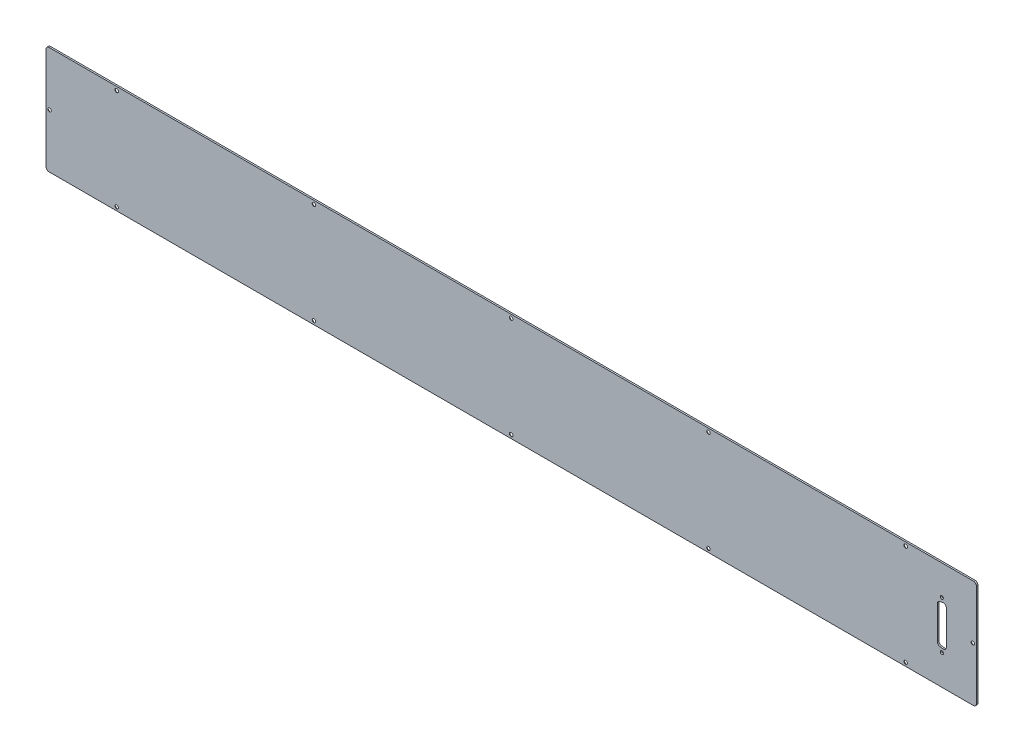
SolidWorks part; units mm, degrees
ref_plane "Front Plane" through (0, 0, 0) normal (0, 0, 1) x (1, 0, 0)
ref_plane "Top Plane" through (0, 0, 0) normal (0, 1, 0) x (1, 0, 0)
ref_plane "Right Plane" through (0, 0, 0) normal (1, 0, 0) x (0, 0, -1)
sketch "Sketch1" plane through (0, 0, 0) normal (0, 0, 1) x (1, 0, 0)
  line L1 (-457.5, -53) -> (457.5, -53)
  line L2 (-457.5, -53) -> (-457.5, 53)
  line L3 (-457.5, 53) -> (457.5, 53)
  line L4 (457.5, -53) -> (457.5, 53)
  line L5 (-457.5, -53) -> (457.5, 53) construction
  line L6 (-457.5, 53) -> (457.5, -53) construction
  point P0 (0, 0)
  dimension "D1" = 106
  dimension "D2" = 915
extrude "Boss-Extrude1" add sketch "Sketch1" along normal blind 1.5748
fillet "Fillet1" radius 3 4 edges at (-457.5, -53, 0.7874) (-457.5, 53, 0.7874) (457.5, -53, 0.7874) (457.5, 53, 0.7874)
hole_wizard "CSK for M3 Flat Head Machine Screw1" positions "Sketch3" profile "Sketch4" countersink size "M3" standard "ANSI Metric"
sketch "Sketch3" plane through (-335.0166, 20.5612, 0) normal (0, 0, 1) x (1, 0, 0)
  line L0 (335.0166, -20.5612) -> (-122.4834, -20.5612) construction
  line L1 (-122.4834, 29.4388) -> (-122.4834, -70.5612) construction
  line L4 (789.5166, 32.4388) -> (-119.4834, 32.4388) construction
  line L5 (335.0166, -20.5612) -> (335.0166, 32.4388) construction
  line L6 (-52.9834, 28.9388) -> (335.0166, 28.9388) construction
  line L7 (-122.4834, 29.4388) -> (-122.4834, -70.5612) construction
  point P0 (-52.9834, 28.9388)
  point P33 (141.0166, 28.9388)
  point P38 (335.0166, 28.9388)
  point P46 (141.0166, -70.0612)
  point P47 (-52.9834, -70.0612)
  point P49 (335.0166, -70.0612)
  point P52 (723.0166, -70.0612)
  point P53 (723.0166, 28.9388)
  point P54 (529.0166, 28.9388)
  point P55 (529.0166, -70.0612)
  point P56 (-118.9834, -20.5612)
  point P61 (789.0166, -20.5612)
sketch "Sketch4" plane through (-388, 49.5, 0) normal (1, 0, 0) x (0, 1, 0)
  line L0 (0, 0) -> (0, 1.5748)
  line L1 (0, 1.5748) -> (1.7, 1.5748)
  line L2 (1.7, 1.5748) -> (1.7, 1.45)
  line L3 (1.7, 1.45) -> (3.15, 0)
  line L5 (3.15, 0) -> (0, 0)
  line L6 (-1.7, 1.45) -> (-3.15, 0) construction
  line L11 (0, -6.35) -> (0, 107.95) construction
  dimension "Thru Hole Dia." = 3.4
  dimension "Thru Hole Depth" = 1.5748
  dimension "Near C'Sink Dia." = 6.3
  dimension "Near C'Sink Angle" = 90
sketch "Sketch9" plane through (0, 0, 0) normal (0, 0, -1) x (-1, 0, 0)
  line L0 (-419.05, 0) -> (457.5, 0) construction
  line L1 (-419.05, 0) -> (-427.95, 0) construction
  line L2 (-427.95, -16.738) -> (-427.95, 16.738)
  line L3 (-424.4291, 19.6924) -> (-421.5291, 19.1811)
  line L4 (-419.05, 16.2266) -> (-419.05, -16.2266)
  line L5 (-423.5, 0) -> (-423.5, 23.5) construction
  line L6 (-424.4291, -19.6924) -> (-421.5291, -19.1811)
  line L7 (457.5, 50) -> (457.5, -50) construction
  line L8 (-457.5, -50) -> (-457.5, 50) construction
  circle A0 centre (-423.5, 23.5) radius 1.55
  arc A1 (-421.5291, 19.1811) -> (-419.05, 16.2266) centre (-422.05, 16.2266) cw
  arc A2 (-427.95, 16.738) -> (-424.4291, 19.6924) centre (-424.95, 16.738) cw
  circle A3 centre (-423.5, -23.5) radius 1.55
  arc A4 (-421.5291, -19.1811) -> (-419.05, -16.2266) centre (-422.05, -16.2266) ccw
  arc A5 (-427.95, -16.738) -> (-424.4291, -19.6924) centre (-424.95, -16.738) ccw
  dimension "D3" = 8.9
  dimension "D4" = 3
  dimension "D2" = 34
  dimension "D6" = 32.4533
  dimension "D17" = 47
  dimension "D8" = 33.476
  dimension "D9" = 3.1
  dimension "D5" = 4.45
extrude "Cut-Extrude1" cut sketch "Sketch9" against normal through all
equation "\"D4@Sketch3\"=\"D3@Sketch3\"/2"
